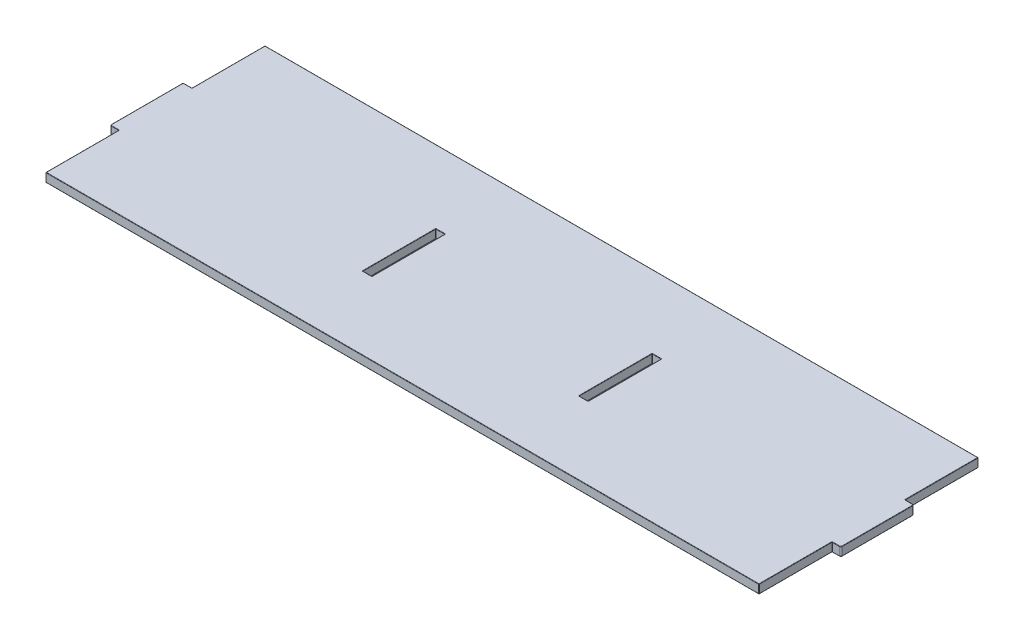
SolidWorks part; units mm, degrees
ref_plane "Front Plane" through (0, 0, 0) normal (0, 0, 1) x (1, 0, 0)
ref_plane "Top Plane" through (0, 0, 0) normal (0, 1, 0) x (1, 0, 0)
ref_plane "Right Plane" through (0, 0, 0) normal (1, 0, 0) x (0, 0, -1)
sketch "Sketch1" plane through (0, 0, 0) normal (0, 1, 0) x (1, 0, 0)
  line L0 (-615.1261, 0) -> (-488, 0) construction
  line L1 (-488, 150) -> (488, 150)
  line L2 (-488, 150) -> (-488, 50)
  line L3 (-488, -150) -> (488, -150)
  line L4 (488, 150) -> (488, 50)
  line L5 (-488, 150) -> (488, -150) construction
  line L6 (-488, -150) -> (488, 150) construction
  line L7 (705.3445, 0) -> (0, 353.6975) construction
  line L8 (0, 353.6975) -> (0, -277.8319) construction
  line L9 (-500, 83.5457) -> (-500, -81.1413) construction
  line L10 (-500, 50) -> (-488, 50)
  line L11 (-500, -50) -> (-488, -50)
  line L12 (0, 0) -> (488, 0) construction
  line L13 (-488, -50) -> (-488, -150)
  line L14 (-500, 50) -> (-500, -50)
  line L15 (500, -50) -> (488, -50)
  line L16 (500, 50) -> (488, 50)
  line L17 (500, 50) -> (500, -50)
  line L18 (488, -50) -> (488, -150)
  line L19 (500, 0) -> (705.3445, 0) construction
  line L20 (-148, 353.6975) -> (-148, -251.7915) construction
  line L21 (-402.2236, 0) -> (91.1306, 0) construction
  line L22 (154.25, -50) -> (141.75, 50) construction
  line L23 (-154.25, 50) -> (-141.75, 50)
  line L24 (-154.25, 50) -> (-154.25, -50)
  line L25 (-154.25, -50) -> (-141.75, -50)
  line L26 (-141.75, 50) -> (-141.75, -50)
  line L27 (-154.25, 50) -> (-141.75, -50) construction
  line L28 (-154.25, -50) -> (-141.75, 50) construction
  line L29 (154.25, 50) -> (141.75, -50) construction
  line L30 (402.2236, 0) -> (-91.1306, 0) construction
  line L31 (148, 353.6975) -> (148, -251.7915) construction
  line L32 (488, -150) -> (-488, 150) construction
  line L33 (488, 150) -> (-488, -150) construction
  line L34 (141.75, 50) -> (141.75, -50)
  line L35 (154.25, -50) -> (141.75, -50)
  line L36 (154.25, 50) -> (154.25, -50)
  line L37 (154.25, 50) -> (141.75, 50)
  point P0 (0, 0)
  point P28 (-148, 0)
  point P41 (148, 0)
  dimension "D1" = 976
  dimension "D2" = 300
  dimension "D3" = 12
  dimension "D4" = 50
  dimension "D5" = 340
  dimension "D6" = 12.5
  dimension "D7" = 100
extrude "Boss-Extrude1" add sketch "Sketch1" along normal blind 12
fillet "Fillet1" radius 2 4 edges at (500, 6, -50) (500, 6, 50) (-500, 6, 50) (-500, 6, -50)
fillet "Fillet2" radius 0.5 64 edges at (154.25, 6, -50) (154.25, 6, 50) (141.75, 6, 50) (141.75, 6, -50) (-154.25, 6, 50) (-154.25, 6, -50) (-141.75, 6, -50) (-141.75, 6, 50) (-488, 6, 50) (-488, 6, -50) (488, 6, 50) (488, 6, -50) (488, 6, -150) (-488, 6, -150) (-488, 6, 150) (488, 6, 150) (148, 0, 50) (141.75, 0, 0) (148, 0, -50) (154.25, 0, 0) (488, 0, -100) (0, 0, -150) (-488, 0, -100) (-493, 0, -50) (-499.4142, 0, -49.4142) (-500, 0, 0) (-499.4142, 0, 49.4142) (-493, 0, 50) (-488, 0, 100) (0, 0, 150) (488, 0, 100) (493, 0, 50) (499.4142, 0, 49.4142) (500, 0, 0) (499.4142, 0, -49.4142) (493, 0, -50) (-148, 0, 50) (-154.25, 0, 0) (-148, 0, -50) (-141.75, 0, 0) (141.75, 12, 0) (148, 12, 50) (154.25, 12, 0) (148, 12, -50) (-154.25, 12, 0) (-148, 12, 50) (-141.75, 12, 0) (-148, 12, -50) (499.4142, 12, 49.4142) (493, 12, 50) (488, 12, 100) (0, 12, 150) (-488, 12, 100) (-493, 12, 50) (-499.4142, 12, 49.4142) (-500, 12, 0) (-499.4142, 12, -49.4142) (-493, 12, -50) (-488, 12, -100) (0, 12, -150) (488, 12, -100) (493, 12, -50) (499.4142, 12, -49.4142) (500, 12, 0)
